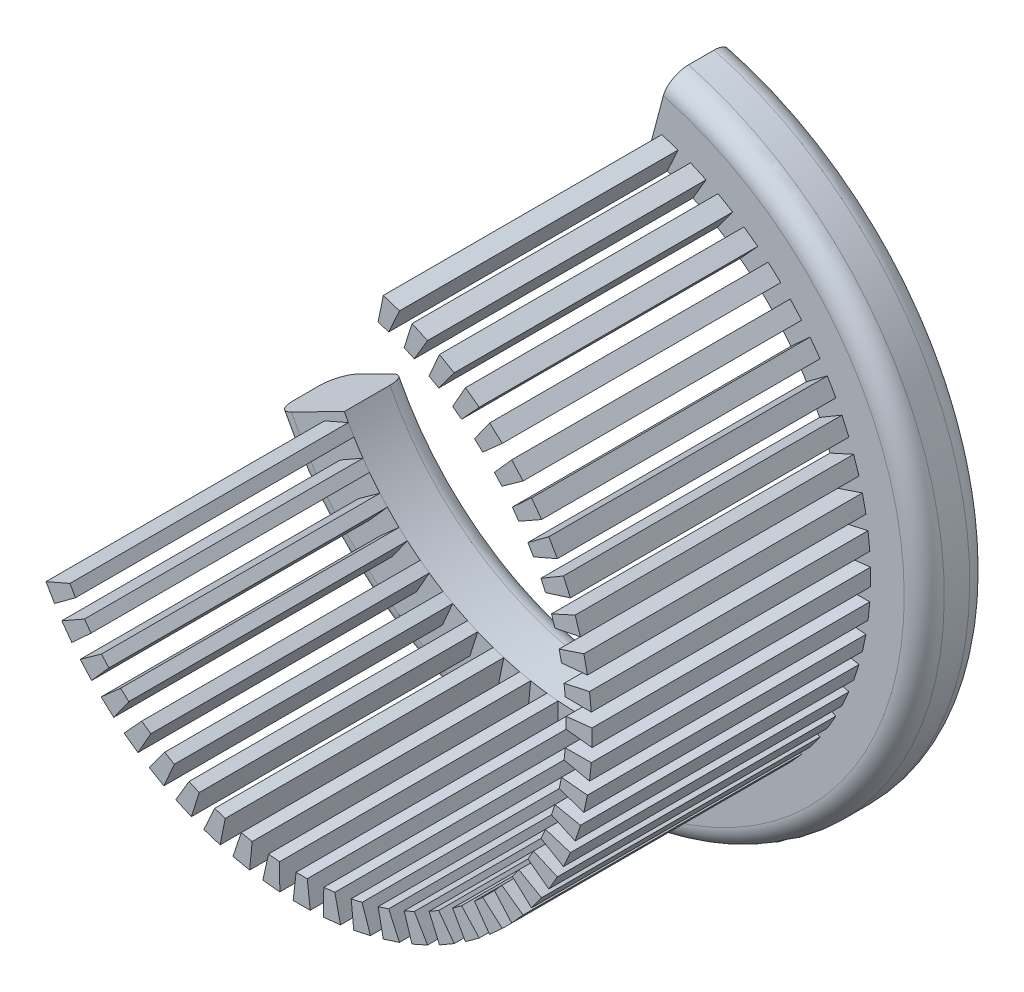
SolidWorks part; units mm, degrees
ref_plane "Přední rovina" through (0, 0, 0) normal (0, 0, 1) x (1, 0, 0)
ref_plane "Horní rovina" through (0, 0, 0) normal (0, 1, 0) x (1, 0, 0)
ref_plane "Pravá rovina" through (0, 0, 0) normal (1, 0, 0) x (0, 0, -1)
sketch "Skica1" plane through (0, 0, 0) normal (0, 0, 1) x (1, 0, 0)
  line L0 (0, 148.7514) -> (0, -162.0328) construction
  line L1 (-203.1858, 0) -> (251.9227, 0) construction
  line L2 (1.4, 79.8) -> (1.4, 78.4875)
  line L3 (0, 78.39) -> (0, 88.6)
  line L4 (-2.6, 88.6) -> (2.6, 88.6)
  line L5 (0, 88.6) -> (0, 80.7)
  line L6 (-1.7, 80.7) -> (1.7, 80.7)
  line L7 (0, 80.7) -> (0, 80.1)
  line L8 (6.7448, 80.4356) -> (10.1261, 80.0802)
  line L9 (1.4, 79.8) -> (1.7, 80.7)
  line L10 (2.6, 88.6) -> (1.7, 80.7)
  line L11 (-1.4, 79.8) -> (-1.7, 80.7)
  line L12 (-2.6, 88.6) -> (-1.7, 80.7)
  line L13 (6.6755, 88.3864) -> (6.7448, 80.4356)
  line L14 (6.6755, 88.3864) -> (11.847, 87.8429)
  line L15 (11.847, 87.8429) -> (10.1261, 80.0802)
  line L16 (6.949, 79.5092) -> (6.7448, 80.4356)
  line L17 (15.1156, 79.29) -> (18.4413, 78.5831)
  line L18 (9.7337, 79.2165) -> (10.1261, 80.0802)
  line L19 (15.8778, 87.2044) -> (15.1156, 79.29)
  line L20 (15.8778, 87.2044) -> (20.9642, 86.1233)
  line L21 (20.9642, 86.1233) -> (18.4413, 78.5831)
  line L22 (15.2219, 78.3473) -> (15.1156, 79.29)
  line L23 (23.3209, 77.2756) -> (26.5545, 76.2249)
  line L24 (17.9608, 77.7651) -> (18.4413, 78.5831)
  line L25 (24.9062, 85.0671) -> (23.3209, 77.2756)
  line L26 (24.9062, 85.0671) -> (29.8517, 83.4602)
  line L27 (29.8517, 83.4602) -> (26.5545, 76.2249)
  line L28 (23.3281, 76.3269) -> (23.3209, 77.2756)
  line L29 (31.2706, 74.4146) -> (34.3767, 73.0317)
  line L30 (25.991, 75.4617) -> (26.5545, 76.2249)
  line L31 (33.6616, 81.9976) -> (31.2706, 74.4146)
  line L32 (33.6616, 81.9976) -> (38.4121, 79.8826)
  line L33 (38.4121, 79.8826) -> (34.3767, 73.0317)
  line L34 (31.1786, 73.4704) -> (31.2706, 74.4146)
  line L35 (38.8778, 70.7383) -> (41.8222, 69.0383)
  line L36 (33.7365, 72.3315) -> (34.3767, 73.0317)
  line L37 (42.0483, 78.0299) -> (38.8778, 70.7383)
  line L38 (42.0483, 78.0299) -> (46.5517, 75.4299)
  line L39 (46.5517, 75.4299) -> (41.8222, 69.0383)
  line L40 (38.6876, 69.8088) -> (38.8778, 70.7383)
  line L41 (46.0589, 66.2869) -> (48.8096, 64.2884)
  line L42 (41.1124, 68.4088) -> (41.8222, 69.0383)
  line L43 (49.9743, 73.2071) -> (46.0589, 66.2869)
  line L44 (49.9743, 73.2071) -> (54.1812, 70.1507)
  line L45 (54.1812, 70.1507) -> (48.8096, 64.2884)
  line L46 (45.7726, 65.3825) -> (46.0589, 66.2869)
  line L47 (52.7355, 61.1093) -> (55.2622, 58.8343)
  line L48 (48.0379, 63.7367) -> (48.8096, 64.2884)
  line L49 (57.3528, 67.5824) -> (52.7355, 61.1093)
  line L50 (57.3528, 67.5824) -> (61.2171, 64.1029)
  line L51 (61.2171, 64.1029) -> (55.2622, 58.8343)
  line L52 (52.3562, 60.2397) -> (52.7355, 61.1093)
  line L53 (58.8343, 55.2622) -> (61.1093, 52.7355)
  line L54 (54.437, 58.3662) -> (55.2622, 58.8343)
  line L55 (64.1029, 61.2171) -> (58.8343, 55.2622)
  line L56 (64.1029, 61.2171) -> (67.5824, 57.3528)
  line L57 (67.5824, 57.3528) -> (61.1093, 52.7355)
  line L58 (58.3662, 54.437) -> (58.8343, 55.2622)
  line L59 (64.2884, 48.8096) -> (66.2869, 46.0589)
  line L60 (60.2397, 52.3562) -> (61.1093, 52.7355)
  line L61 (70.1507, 54.1812) -> (64.2884, 48.8096)
  line L62 (70.1507, 54.1812) -> (73.2071, 49.9743)
  line L63 (73.2071, 49.9743) -> (66.2869, 46.0589)
  line L64 (63.7367, 48.0379) -> (64.2884, 48.8096)
  line L65 (69.0383, 41.8222) -> (70.7383, 38.8778)
  line L66 (65.3825, 45.7726) -> (66.2869, 46.0589)
  line L67 (75.4299, 46.5517) -> (69.0383, 41.8222)
  line L68 (75.4299, 46.5517) -> (78.0299, 42.0483)
  line L69 (78.0299, 42.0483) -> (70.7383, 38.8778)
  line L70 (68.4088, 41.1124) -> (69.0383, 41.8222)
  line L71 (73.0317, 34.3767) -> (74.4146, 31.2706)
  line L72 (69.8088, 38.6876) -> (70.7383, 38.8778)
  line L73 (79.8826, 38.4121) -> (73.0317, 34.3767)
  line L74 (79.8826, 38.4121) -> (81.9976, 33.6616)
  line L75 (81.9976, 33.6616) -> (74.4146, 31.2706)
  line L76 (72.3315, 33.7365) -> (73.0317, 34.3767)
  line L77 (76.2249, 26.5545) -> (77.2756, 23.3209)
  line L78 (73.4704, 31.1786) -> (74.4146, 31.2706)
  line L79 (83.4602, 29.8517) -> (76.2249, 26.5545)
  line L80 (83.4602, 29.8517) -> (85.0671, 24.9062)
  line L81 (85.0671, 24.9062) -> (77.2756, 23.3209)
  line L82 (75.4617, 25.991) -> (76.2249, 26.5545)
  line L83 (78.5831, 18.4413) -> (79.29, 15.1156)
  line L84 (76.3269, 23.3281) -> (77.2756, 23.3209)
  line L85 (86.1233, 20.9642) -> (78.5831, 18.4413)
  line L86 (86.1233, 20.9642) -> (87.2044, 15.8778)
  line L87 (87.2044, 15.8778) -> (79.29, 15.1156)
  line L88 (77.7651, 17.9608) -> (78.5831, 18.4413)
  line L89 (80.0802, 10.1261) -> (80.4356, 6.7448)
  line L90 (78.3473, 15.2219) -> (79.29, 15.1156)
  line L91 (87.8429, 11.847) -> (80.0802, 10.1261)
  line L92 (87.8429, 11.847) -> (88.3864, 6.6755)
  line L93 (88.3864, 6.6755) -> (80.4356, 6.7448)
  line L94 (79.2165, 9.7337) -> (80.0802, 10.1261)
  line L95 (80.7, 1.7) -> (80.7, -1.7)
  line L96 (79.5092, 6.949) -> (80.4356, 6.7448)
  line L97 (88.6, 2.6) -> (80.7, 1.7)
  line L98 (88.6, 2.6) -> (88.6, -2.6)
  line L99 (88.6, -2.6) -> (80.7, -1.7)
  line L100 (79.8, 1.4) -> (80.7, 1.7)
  line L101 (80.4356, -6.7448) -> (80.0802, -10.1261)
  line L102 (79.8, -1.4) -> (80.7, -1.7)
  line L103 (88.3864, -6.6755) -> (80.4356, -6.7448)
  line L104 (88.3864, -6.6755) -> (87.8429, -11.847)
  line L105 (87.8429, -11.847) -> (80.0802, -10.1261)
  line L106 (79.5092, -6.949) -> (80.4356, -6.7448)
  line L107 (79.29, -15.1156) -> (78.5831, -18.4413)
  line L108 (79.2165, -9.7337) -> (80.0802, -10.1261)
  line L109 (87.2044, -15.8778) -> (79.29, -15.1156)
  line L110 (87.2044, -15.8778) -> (86.1233, -20.9642)
  line L111 (86.1233, -20.9642) -> (78.5831, -18.4413)
  line L112 (78.3473, -15.2219) -> (79.29, -15.1156)
  line L113 (77.2756, -23.3209) -> (76.2249, -26.5545)
  line L114 (77.7651, -17.9608) -> (78.5831, -18.4413)
  line L115 (85.0671, -24.9062) -> (77.2756, -23.3209)
  line L116 (85.0671, -24.9062) -> (83.4602, -29.8517)
  line L117 (83.4602, -29.8517) -> (76.2249, -26.5545)
  line L118 (76.3269, -23.3281) -> (77.2756, -23.3209)
  line L119 (74.4146, -31.2706) -> (73.0317, -34.3767)
  line L120 (75.4617, -25.991) -> (76.2249, -26.5545)
  line L121 (81.9976, -33.6616) -> (74.4146, -31.2706)
  line L122 (81.9976, -33.6616) -> (79.8826, -38.4121)
  line L123 (79.8826, -38.4121) -> (73.0317, -34.3767)
  line L124 (73.4704, -31.1786) -> (74.4146, -31.2706)
  line L125 (70.7383, -38.8778) -> (69.0383, -41.8222)
  line L126 (72.3315, -33.7365) -> (73.0317, -34.3767)
  line L127 (78.0299, -42.0483) -> (70.7383, -38.8778)
  line L128 (78.0299, -42.0483) -> (75.4299, -46.5517)
  line L129 (75.4299, -46.5517) -> (69.0383, -41.8222)
  line L130 (69.8088, -38.6876) -> (70.7383, -38.8778)
  line L131 (66.2869, -46.0589) -> (64.2884, -48.8096)
  line L132 (68.4088, -41.1124) -> (69.0383, -41.8222)
  line L133 (73.2071, -49.9743) -> (66.2869, -46.0589)
  line L134 (73.2071, -49.9743) -> (70.1507, -54.1812)
  line L135 (70.1507, -54.1812) -> (64.2884, -48.8096)
  line L136 (65.3825, -45.7726) -> (66.2869, -46.0589)
  line L137 (61.1093, -52.7355) -> (58.8343, -55.2622)
  line L138 (63.7367, -48.0379) -> (64.2884, -48.8096)
  line L139 (67.5824, -57.3528) -> (61.1093, -52.7355)
  line L140 (67.5824, -57.3528) -> (64.1029, -61.2171)
  line L141 (64.1029, -61.2171) -> (58.8343, -55.2622)
  line L142 (60.2397, -52.3562) -> (61.1093, -52.7355)
  line L143 (55.2622, -58.8343) -> (52.7355, -61.1093)
  line L144 (58.3662, -54.437) -> (58.8343, -55.2622)
  line L145 (61.2171, -64.1029) -> (55.2622, -58.8343)
  line L146 (61.2171, -64.1029) -> (57.3528, -67.5824)
  line L147 (57.3528, -67.5824) -> (52.7355, -61.1093)
  line L148 (54.437, -58.3662) -> (55.2622, -58.8343)
  line L149 (48.8096, -64.2884) -> (46.0589, -66.2869)
  line L150 (52.3562, -60.2397) -> (52.7355, -61.1093)
  line L151 (54.1812, -70.1507) -> (48.8096, -64.2884)
  line L152 (54.1812, -70.1507) -> (49.9743, -73.2071)
  line L153 (49.9743, -73.2071) -> (46.0589, -66.2869)
  line L154 (48.0379, -63.7367) -> (48.8096, -64.2884)
  line L155 (41.8222, -69.0383) -> (38.8778, -70.7383)
  line L156 (45.7726, -65.3825) -> (46.0589, -66.2869)
  line L157 (46.5517, -75.4299) -> (41.8222, -69.0383)
  line L158 (46.5517, -75.4299) -> (42.0483, -78.0299)
  line L159 (42.0483, -78.0299) -> (38.8778, -70.7383)
  line L160 (41.1124, -68.4088) -> (41.8222, -69.0383)
  line L161 (34.3767, -73.0317) -> (31.2706, -74.4146)
  line L162 (38.6876, -69.8088) -> (38.8778, -70.7383)
  line L163 (38.4121, -79.8826) -> (34.3767, -73.0317)
  line L164 (38.4121, -79.8826) -> (33.6616, -81.9976)
  line L165 (33.6616, -81.9976) -> (31.2706, -74.4146)
  line L166 (33.7365, -72.3315) -> (34.3767, -73.0317)
  line L167 (26.5545, -76.2249) -> (23.3209, -77.2756)
  line L168 (31.1786, -73.4704) -> (31.2706, -74.4146)
  line L169 (29.8517, -83.4602) -> (26.5545, -76.2249)
  line L170 (29.8517, -83.4602) -> (24.9062, -85.0671)
  line L171 (24.9062, -85.0671) -> (23.3209, -77.2756)
  line L172 (25.991, -75.4617) -> (26.5545, -76.2249)
  line L173 (18.4413, -78.5831) -> (15.1156, -79.29)
  line L174 (23.3281, -76.3269) -> (23.3209, -77.2756)
  line L175 (20.9642, -86.1233) -> (18.4413, -78.5831)
  line L176 (20.9642, -86.1233) -> (15.8778, -87.2044)
  line L177 (15.8778, -87.2044) -> (15.1156, -79.29)
  line L178 (17.9608, -77.7651) -> (18.4413, -78.5831)
  line L179 (10.1261, -80.0802) -> (6.7448, -80.4356)
  line L180 (15.2219, -78.3473) -> (15.1156, -79.29)
  line L181 (11.847, -87.8429) -> (10.1261, -80.0802)
  line L182 (11.847, -87.8429) -> (6.6755, -88.3864)
  line L183 (6.6755, -88.3864) -> (6.7448, -80.4356)
  line L184 (9.7337, -79.2165) -> (10.1261, -80.0802)
  line L185 (1.7, -80.7) -> (-1.7, -80.7)
  line L186 (6.949, -79.5092) -> (6.7448, -80.4356)
  line L187 (2.6, -88.6) -> (1.7, -80.7)
  line L188 (2.6, -88.6) -> (-2.6, -88.6)
  line L189 (-2.6, -88.6) -> (-1.7, -80.7)
  line L190 (1.4, -79.8) -> (1.7, -80.7)
  line L191 (-6.7448, -80.4356) -> (-10.1261, -80.0802)
  line L192 (-1.4, -79.8) -> (-1.7, -80.7)
  line L193 (-6.6755, -88.3864) -> (-6.7448, -80.4356)
  line L194 (-6.6755, -88.3864) -> (-11.847, -87.8429)
  line L195 (-11.847, -87.8429) -> (-10.1261, -80.0802)
  line L196 (-6.949, -79.5092) -> (-6.7448, -80.4356)
  line L197 (-15.1156, -79.29) -> (-18.4413, -78.5831)
  line L198 (-9.7337, -79.2165) -> (-10.1261, -80.0802)
  line L199 (-15.8778, -87.2044) -> (-15.1156, -79.29)
  line L200 (-15.8778, -87.2044) -> (-20.9642, -86.1233)
  line L201 (-20.9642, -86.1233) -> (-18.4413, -78.5831)
  line L202 (-15.2219, -78.3473) -> (-15.1156, -79.29)
  line L203 (-23.3209, -77.2756) -> (-26.5545, -76.2249)
  line L204 (-17.9608, -77.7651) -> (-18.4413, -78.5831)
  line L205 (-24.9062, -85.0671) -> (-23.3209, -77.2756)
  line L206 (-24.9062, -85.0671) -> (-29.8517, -83.4602)
  line L207 (-29.8517, -83.4602) -> (-26.5545, -76.2249)
  line L208 (-23.3281, -76.3269) -> (-23.3209, -77.2756)
  line L209 (-31.2706, -74.4146) -> (-34.3767, -73.0317)
  line L210 (-25.991, -75.4617) -> (-26.5545, -76.2249)
  line L211 (-33.6616, -81.9976) -> (-31.2706, -74.4146)
  line L212 (-33.6616, -81.9976) -> (-38.4121, -79.8826)
  line L213 (-38.4121, -79.8826) -> (-34.3767, -73.0317)
  line L214 (-31.1786, -73.4704) -> (-31.2706, -74.4146)
  line L215 (-38.8778, -70.7383) -> (-41.8222, -69.0383)
  line L216 (-33.7365, -72.3315) -> (-34.3767, -73.0317)
  line L217 (-42.0483, -78.0299) -> (-38.8778, -70.7383)
  line L218 (-42.0483, -78.0299) -> (-46.5517, -75.4299)
  line L219 (-46.5517, -75.4299) -> (-41.8222, -69.0383)
  line L220 (-38.6876, -69.8088) -> (-38.8778, -70.7383)
  line L221 (-46.0589, -66.2869) -> (-48.8096, -64.2884)
  line L222 (-41.1124, -68.4088) -> (-41.8222, -69.0383)
  line L223 (-49.9743, -73.2071) -> (-46.0589, -66.2869)
  line L224 (-49.9743, -73.2071) -> (-54.1812, -70.1507)
  line L225 (-54.1812, -70.1507) -> (-48.8096, -64.2884)
  line L226 (-45.7726, -65.3825) -> (-46.0589, -66.2869)
  line L227 (-45.7726, -65.3825) -> (-48.0379, -63.7367)
  line L228 (-48.0379, -63.7367) -> (-48.8096, -64.2884)
  line L229 (-57.3528, -67.5824) -> (-52.7355, -61.1093)
  line L230 (-57.3528, -67.5824) -> (-61.2171, -64.1029)
  line L231 (-61.2171, -64.1029) -> (-55.2622, -58.8343)
  line L232 (-52.3562, -60.2397) -> (-52.7355, -61.1093)
  line L233 (-52.7355, -61.1093) -> (-55.2622, -58.8343)
  line L234 (-54.437, -58.3662) -> (-55.2622, -58.8343)
  line L235 (-64.1029, -61.2171) -> (-58.8343, -55.2622)
  line L236 (-64.1029, -61.2171) -> (-67.5824, -57.3528)
  line L237 (-67.5824, -57.3528) -> (-61.1093, -52.7355)
  line L238 (-58.3662, -54.437) -> (-58.8343, -55.2622)
  line L239 (-58.8343, -55.2622) -> (-61.1093, -52.7355)
  line L240 (-60.2397, -52.3562) -> (-61.1093, -52.7355)
  line L241 (-70.1507, -54.1812) -> (-64.2884, -48.8096)
  line L242 (-70.1507, -54.1812) -> (-73.2071, -49.9743)
  line L243 (-73.2071, -49.9743) -> (-66.2869, -46.0589)
  line L244 (-63.7367, -48.0379) -> (-64.2884, -48.8096)
  line L245 (-64.2884, -48.8096) -> (-66.2869, -46.0589)
  line L246 (-65.3825, -45.7726) -> (-66.2869, -46.0589)
  line L247 (-75.4299, -46.5517) -> (-69.0383, -41.8222)
  line L248 (-75.4299, -46.5517) -> (-78.0299, -42.0483)
  line L249 (-78.0299, -42.0483) -> (-70.7383, -38.8778)
  line L250 (-68.4088, -41.1124) -> (-69.0383, -41.8222)
  line L251 (-69.0383, -41.8222) -> (-70.7383, -38.8778)
  line L252 (-69.8088, -38.6876) -> (-70.7383, -38.8778)
  line L253 (-79.8826, -38.4121) -> (-73.0317, -34.3767)
  line L254 (-79.8826, -38.4121) -> (-81.9976, -33.6616)
  line L255 (-81.9976, -33.6616) -> (-74.4146, -31.2706)
  line L256 (-72.3315, -33.7365) -> (-73.0317, -34.3767)
  line L257 (-73.0317, -34.3767) -> (-74.4146, -31.2706)
  line L258 (-73.4704, -31.1786) -> (-74.4146, -31.2706)
  line L259 (-83.4602, -29.8517) -> (-76.2249, -26.5545)
  line L260 (-83.4602, -29.8517) -> (-85.0671, -24.9062)
  line L261 (-85.0671, -24.9062) -> (-77.2756, -23.3209)
  line L262 (-75.4617, -25.991) -> (-76.2249, -26.5545)
  line L263 (-75.4617, -25.991) -> (-76.3269, -23.3281)
  line L264 (-76.3269, -23.3281) -> (-77.2756, -23.3209)
  line L265 (-86.1233, -20.9642) -> (-78.5831, -18.4413)
  line L266 (-86.1233, -20.9642) -> (-87.2044, -15.8778)
  line L267 (-87.2044, -15.8778) -> (-79.29, -15.1156)
  line L268 (-77.7651, -17.9608) -> (-78.5831, -18.4413)
  line L269 (-77.7651, -17.9608) -> (-78.3473, -15.2219)
  line L270 (-78.3473, -15.2219) -> (-79.29, -15.1156)
  line L271 (-87.8429, -11.847) -> (-80.0802, -10.1261)
  line L272 (-87.8429, -11.847) -> (-88.3864, -6.6755)
  line L273 (-88.3864, -6.6755) -> (-80.4356, -6.7448)
  line L274 (-79.2165, -9.7337) -> (-80.0802, -10.1261)
  line L275 (-76.2249, -26.5545) -> (-77.2756, -23.3209)
  line L276 (-79.5092, -6.949) -> (-80.4356, -6.7448)
  line L277 (-88.6, -2.6) -> (-80.7, -1.7)
  line L278 (-88.6, -2.6) -> (-88.6, 2.6)
  line L279 (-88.6, 2.6) -> (-80.7, 1.7)
  line L280 (-79.8, -1.4) -> (-80.7, -1.7)
  line L281 (-78.5831, -18.4413) -> (-79.29, -15.1156)
  line L282 (-79.8, 1.4) -> (-80.7, 1.7)
  line L283 (-88.3864, 6.6755) -> (-80.4356, 6.7448)
  line L284 (-88.3864, 6.6755) -> (-87.8429, 11.847)
  line L285 (-87.8429, 11.847) -> (-80.0802, 10.1261)
  line L286 (-79.5092, 6.949) -> (-80.4356, 6.7448)
  line L287 (-80.0802, -10.1261) -> (-80.4356, -6.7448)
  line L288 (-79.2165, 9.7337) -> (-80.0802, 10.1261)
  line L289 (-87.2044, 15.8778) -> (-79.29, 15.1156)
  line L290 (-87.2044, 15.8778) -> (-86.1233, 20.9642)
  line L291 (-86.1233, 20.9642) -> (-78.5831, 18.4413)
  line L292 (-78.3473, 15.2219) -> (-79.29, 15.1156)
  line L293 (-80.7, -1.7) -> (-80.7, 1.7)
  line L294 (-77.7651, 17.9608) -> (-78.5831, 18.4413)
  line L295 (-85.0671, 24.9062) -> (-77.2756, 23.3209)
  line L296 (-85.0671, 24.9062) -> (-83.4602, 29.8517)
  line L297 (-83.4602, 29.8517) -> (-76.2249, 26.5545)
  line L298 (-76.3269, 23.3281) -> (-77.2756, 23.3209)
  line L299 (-80.4356, 6.7448) -> (-80.0802, 10.1261)
  line L300 (-75.4617, 25.991) -> (-76.2249, 26.5545)
  line L301 (-81.9976, 33.6616) -> (-74.4146, 31.2706)
  line L302 (-81.9976, 33.6616) -> (-79.8826, 38.4121)
  line L303 (-79.8826, 38.4121) -> (-73.0317, 34.3767)
  line L304 (-73.4704, 31.1786) -> (-74.4146, 31.2706)
  line L305 (-79.29, 15.1156) -> (-78.5831, 18.4413)
  line L306 (-72.3315, 33.7365) -> (-73.0317, 34.3767)
  line L307 (-78.0299, 42.0483) -> (-70.7383, 38.8778)
  line L308 (-78.0299, 42.0483) -> (-75.4299, 46.5517)
  line L309 (-75.4299, 46.5517) -> (-69.0383, 41.8222)
  line L310 (-69.8088, 38.6876) -> (-70.7383, 38.8778)
  line L311 (-77.2756, 23.3209) -> (-76.2249, 26.5545)
  line L312 (-68.4088, 41.1124) -> (-69.0383, 41.8222)
  line L313 (-73.2071, 49.9743) -> (-66.2869, 46.0589)
  line L314 (-73.2071, 49.9743) -> (-70.1507, 54.1812)
  line L315 (-70.1507, 54.1812) -> (-64.2884, 48.8096)
  line L316 (-65.3825, 45.7726) -> (-66.2869, 46.0589)
  line L317 (-74.4146, 31.2706) -> (-73.0317, 34.3767)
  line L318 (-63.7367, 48.0379) -> (-64.2884, 48.8096)
  line L319 (-67.5824, 57.3528) -> (-61.1093, 52.7355)
  line L320 (-67.5824, 57.3528) -> (-64.1029, 61.2171)
  line L321 (-64.1029, 61.2171) -> (-58.8343, 55.2622)
  line L322 (-60.2397, 52.3562) -> (-61.1093, 52.7355)
  line L323 (-70.7383, 38.8778) -> (-69.0383, 41.8222)
  line L324 (-58.3662, 54.437) -> (-58.8343, 55.2622)
  line L325 (-61.2171, 64.1029) -> (-55.2622, 58.8343)
  line L326 (-61.2171, 64.1029) -> (-57.3528, 67.5824)
  line L327 (-57.3528, 67.5824) -> (-52.7355, 61.1093)
  line L328 (-54.437, 58.3662) -> (-55.2622, 58.8343)
  line L329 (-66.2869, 46.0589) -> (-64.2884, 48.8096)
  line L330 (-52.3562, 60.2397) -> (-52.7355, 61.1093)
  line L331 (-54.1812, 70.1507) -> (-48.8096, 64.2884)
  line L332 (-54.1812, 70.1507) -> (-49.9743, 73.2071)
  line L333 (-49.9743, 73.2071) -> (-46.0589, 66.2869)
  line L334 (-48.0379, 63.7367) -> (-48.8096, 64.2884)
  line L335 (-61.1093, 52.7355) -> (-58.8343, 55.2622)
  line L336 (-45.7726, 65.3825) -> (-46.0589, 66.2869)
  line L337 (-46.5517, 75.4299) -> (-41.8222, 69.0383)
  line L338 (-46.5517, 75.4299) -> (-42.0483, 78.0299)
  line L339 (-42.0483, 78.0299) -> (-38.8778, 70.7383)
  line L340 (-41.1124, 68.4088) -> (-41.8222, 69.0383)
  line L341 (-55.2622, 58.8343) -> (-52.7355, 61.1093)
  line L342 (-38.6876, 69.8088) -> (-38.8778, 70.7383)
  line L343 (-38.4121, 79.8826) -> (-34.3767, 73.0317)
  line L344 (-38.4121, 79.8826) -> (-33.6616, 81.9976)
  line L345 (-33.6616, 81.9976) -> (-31.2706, 74.4146)
  line L346 (-33.7365, 72.3315) -> (-34.3767, 73.0317)
  line L347 (-48.8096, 64.2884) -> (-46.0589, 66.2869)
  line L348 (-31.1786, 73.4704) -> (-31.2706, 74.4146)
  line L349 (-29.8517, 83.4602) -> (-26.5545, 76.2249)
  line L350 (-29.8517, 83.4602) -> (-24.9062, 85.0671)
  line L351 (-24.9062, 85.0671) -> (-23.3209, 77.2756)
  line L352 (-25.991, 75.4617) -> (-26.5545, 76.2249)
  line L353 (-41.8222, 69.0383) -> (-38.8778, 70.7383)
  line L354 (-23.3281, 76.3269) -> (-23.3209, 77.2756)
  line L355 (-20.9642, 86.1233) -> (-18.4413, 78.5831)
  line L356 (-20.9642, 86.1233) -> (-15.8778, 87.2044)
  line L357 (-15.8778, 87.2044) -> (-15.1156, 79.29)
  line L358 (-17.9608, 77.7651) -> (-18.4413, 78.5831)
  line L359 (-34.3767, 73.0317) -> (-31.2706, 74.4146)
  line L360 (-15.2219, 78.3473) -> (-15.1156, 79.29)
  line L361 (-11.847, 87.8429) -> (-10.1261, 80.0802)
  line L362 (-11.847, 87.8429) -> (-6.6755, 88.3864)
  line L363 (-6.6755, 88.3864) -> (-6.7448, 80.4356)
  line L364 (-9.7337, 79.2165) -> (-10.1261, 80.0802)
  line L365 (-26.5545, 76.2249) -> (-23.3209, 77.2756)
  line L366 (-6.949, 79.5092) -> (-6.7448, 80.4356)
  line L367 (-1.4, 79.8) -> (-1.4, 78.4875)
  line L368 (6.949, 79.5092) -> (6.8118, 78.2039)
  line L369 (9.7337, 79.2165) -> (9.5965, 77.9112)
  line L370 (15.2219, 78.3473) -> (14.9491, 77.0635)
  line L371 (17.9608, 77.7651) -> (17.6879, 76.4813)
  line L372 (23.3281, 76.3269) -> (22.9225, 75.0787)
  line L373 (25.991, 75.4617) -> (25.5855, 74.2134)
  line L374 (31.1786, 73.4704) -> (30.6448, 72.2713)
  line L375 (33.7365, 72.3315) -> (33.2027, 71.1325)
  line L376 (38.6876, 69.8088) -> (38.0313, 68.6722)
  line L377 (41.1124, 68.4088) -> (40.4562, 67.2722)
  line L378 (45.7726, 65.3825) -> (45.0012, 64.3206)
  line L379 (48.0379, 63.7367) -> (47.2664, 62.6748)
  line L380 (52.3562, 60.2397) -> (51.478, 59.2644)
  line L381 (54.437, 58.3662) -> (53.5588, 57.3908)
  line L382 (58.3662, 54.437) -> (57.3908, 53.5588)
  line L383 (60.2397, 52.3562) -> (59.2644, 51.478)
  line L384 (63.7367, 48.0379) -> (62.6748, 47.2664)
  line L385 (65.3825, 45.7726) -> (64.3206, 45.0012)
  line L386 (68.4088, 41.1124) -> (67.2722, 40.4562)
  line L387 (69.8088, 38.6876) -> (68.6722, 38.0313)
  line L388 (72.3315, 33.7365) -> (71.1325, 33.2027)
  line L389 (73.4704, 31.1786) -> (72.2713, 30.6448)
  line L390 (75.4617, 25.991) -> (74.2134, 25.5855)
  line L391 (76.3269, 23.3281) -> (75.0787, 22.9225)
  line L392 (77.7651, 17.9608) -> (76.4813, 17.6879)
  line L393 (78.3473, 15.2219) -> (77.0635, 14.9491)
  line L394 (79.2165, 9.7337) -> (77.9112, 9.5965)
  line L395 (79.5092, 6.949) -> (78.2039, 6.8118)
  line L396 (79.8, 1.4) -> (78.4875, 1.4)
  line L397 (79.8, -1.4) -> (78.4875, -1.4)
  line L398 (79.5092, -6.949) -> (78.2039, -6.8118)
  line L399 (79.2165, -9.7337) -> (77.9112, -9.5965)
  line L400 (78.3473, -15.2219) -> (77.0635, -14.9491)
  line L401 (77.7651, -17.9608) -> (76.4813, -17.6879)
  line L402 (76.3269, -23.3281) -> (75.0787, -22.9225)
  line L403 (75.4617, -25.991) -> (74.2134, -25.5855)
  line L404 (73.4704, -31.1786) -> (72.2713, -30.6448)
  line L405 (72.3315, -33.7365) -> (71.1325, -33.2027)
  line L406 (69.8088, -38.6876) -> (68.6722, -38.0313)
  line L407 (68.4088, -41.1124) -> (67.2722, -40.4562)
  line L408 (65.3825, -45.7726) -> (64.3206, -45.0012)
  line L409 (63.7367, -48.0379) -> (62.6748, -47.2664)
  line L410 (60.2397, -52.3562) -> (59.2644, -51.478)
  line L411 (58.3662, -54.437) -> (57.3908, -53.5588)
  line L412 (54.437, -58.3662) -> (53.5588, -57.3908)
  line L413 (52.3562, -60.2397) -> (51.478, -59.2644)
  line L414 (48.0379, -63.7367) -> (47.2664, -62.6748)
  line L415 (45.7726, -65.3825) -> (45.0012, -64.3206)
  line L416 (41.1124, -68.4088) -> (40.4562, -67.2722)
  line L417 (38.6876, -69.8088) -> (38.0313, -68.6722)
  line L418 (33.7365, -72.3315) -> (33.2027, -71.1325)
  line L419 (31.1786, -73.4704) -> (30.6448, -72.2713)
  line L420 (25.991, -75.4617) -> (25.5855, -74.2134)
  line L421 (23.3281, -76.3269) -> (22.9225, -75.0787)
  line L422 (17.9608, -77.7651) -> (17.6879, -76.4813)
  line L423 (15.2219, -78.3473) -> (14.9491, -77.0635)
  line L424 (9.7337, -79.2165) -> (9.5965, -77.9112)
  line L425 (6.949, -79.5092) -> (6.8118, -78.2039)
  line L426 (1.4, -79.8) -> (1.4, -78.4875)
  line L427 (-1.4, -79.8) -> (-1.4, -78.4875)
  line L428 (-6.949, -79.5092) -> (-6.8118, -78.2039)
  line L429 (-9.7337, -79.2165) -> (-9.5965, -77.9112)
  line L430 (-15.2219, -78.3473) -> (-14.9491, -77.0635)
  line L431 (-17.9608, -77.7651) -> (-17.6879, -76.4813)
  line L432 (-23.3281, -76.3269) -> (-22.9225, -75.0787)
  line L433 (-25.991, -75.4617) -> (-25.5855, -74.2134)
  line L434 (-31.1786, -73.4704) -> (-30.6448, -72.2713)
  line L435 (-33.7365, -72.3315) -> (-33.2027, -71.1325)
  line L436 (-38.6876, -69.8088) -> (-38.0313, -68.6722)
  line L437 (-41.1124, -68.4088) -> (-40.4562, -67.2722)
  line L438 (-45.7726, -65.3825) -> (-45.0012, -64.3206)
  line L439 (-48.0379, -63.7367) -> (-47.2664, -62.6748)
  line L440 (-52.3562, -60.2397) -> (-51.478, -59.2644)
  line L441 (-54.437, -58.3662) -> (-53.5588, -57.3908)
  line L442 (-58.3662, -54.437) -> (-57.3908, -53.5588)
  line L443 (-60.2397, -52.3562) -> (-59.2644, -51.478)
  line L444 (-63.7367, -48.0379) -> (-62.6748, -47.2664)
  line L445 (-65.3825, -45.7726) -> (-64.3206, -45.0012)
  line L446 (-68.4088, -41.1124) -> (-67.2722, -40.4562)
  line L447 (-69.8088, -38.6876) -> (-68.6722, -38.0313)
  line L448 (-72.3315, -33.7365) -> (-71.1325, -33.2027)
  line L449 (-73.4704, -31.1786) -> (-72.2713, -30.6448)
  line L450 (-75.4617, -25.991) -> (-74.2134, -25.5855)
  line L451 (-76.3269, -23.3281) -> (-75.0787, -22.9225)
  line L452 (-77.7651, -17.9608) -> (-76.4813, -17.6879)
  line L453 (-78.3473, -15.2219) -> (-77.0635, -14.9491)
  line L454 (-79.2165, -9.7337) -> (-77.9112, -9.5965)
  line L455 (-79.5092, -6.949) -> (-78.2039, -6.8118)
  line L456 (-79.8, -1.4) -> (-78.4875, -1.4)
  line L457 (-79.8, 1.4) -> (-78.4875, 1.4)
  line L458 (-79.5092, 6.949) -> (-78.2039, 6.8118)
  line L459 (-79.2165, 9.7337) -> (-77.9112, 9.5965)
  line L460 (-78.3473, 15.2219) -> (-77.0635, 14.9491)
  line L461 (-77.7651, 17.9608) -> (-76.4813, 17.6879)
  line L462 (-76.3269, 23.3281) -> (-75.0787, 22.9225)
  line L463 (-75.4617, 25.991) -> (-74.2134, 25.5855)
  line L464 (-73.4704, 31.1786) -> (-72.2713, 30.6448)
  line L465 (-72.3315, 33.7365) -> (-71.1325, 33.2027)
  line L466 (-69.8088, 38.6876) -> (-68.6722, 38.0313)
  line L467 (-68.4088, 41.1124) -> (-67.2722, 40.4562)
  line L468 (-65.3825, 45.7726) -> (-64.3206, 45.0012)
  line L469 (-63.7367, 48.0379) -> (-62.6748, 47.2664)
  line L470 (-60.2397, 52.3562) -> (-59.2644, 51.478)
  line L471 (-58.3662, 54.437) -> (-57.3908, 53.5588)
  line L472 (-54.437, 58.3662) -> (-53.5588, 57.3908)
  line L473 (-52.3562, 60.2397) -> (-51.478, 59.2644)
  line L474 (-48.0379, 63.7367) -> (-47.2664, 62.6748)
  line L475 (-45.7726, 65.3825) -> (-45.0012, 64.3206)
  line L476 (-41.1124, 68.4088) -> (-40.4562, 67.2722)
  line L477 (-38.6876, 69.8088) -> (-38.0313, 68.6722)
  line L478 (-33.7365, 72.3315) -> (-33.2027, 71.1325)
  line L479 (-31.1786, 73.4704) -> (-30.6448, 72.2713)
  line L480 (-25.991, 75.4617) -> (-25.5855, 74.2134)
  line L481 (-23.3281, 76.3269) -> (-22.9225, 75.0787)
  line L482 (-17.9608, 77.7651) -> (-17.6879, 76.4813)
  line L483 (-15.2219, 78.3473) -> (-14.9491, 77.0635)
  line L484 (-9.7337, 79.2165) -> (-9.5965, 77.9112)
  line L485 (-6.949, 79.5092) -> (-6.8118, 78.2039)
  line L486 (-18.4413, 78.5831) -> (-15.1156, 79.29)
  line L487 (-10.1261, 80.0802) -> (-6.7448, 80.4356)
  arc A0 (-1.4, 78.4875) -> (-6.8118, 78.2039) centre (0, 0) ccw
  circle A1 centre (0, 0) radius 127
  arc A2 (-9.5965, 77.9112) -> (-14.9491, 77.0635) centre (0, 0) ccw
  arc A3 (-17.6879, 76.4813) -> (-22.9225, 75.0787) centre (0, 0) ccw
  arc A4 (-25.5855, 74.2134) -> (-30.6448, 72.2713) centre (0, 0) ccw
  arc A5 (6.8118, 78.2039) -> (1.4, 78.4875) centre (0, 0) ccw
  arc A6 (14.9491, 77.0635) -> (9.5965, 77.9112) centre (0, 0) ccw
  arc A7 (-33.2027, 71.1325) -> (-38.0313, 68.6722) centre (0, 0) ccw
  arc A8 (-40.4562, 67.2722) -> (-45.0012, 64.3206) centre (0, 0) ccw
  arc A9 (-47.2664, 62.6748) -> (-51.478, 59.2644) centre (0, 0) ccw
  arc A10 (-53.5588, 57.3908) -> (-57.3908, 53.5588) centre (0, 0) ccw
  arc A11 (-59.2644, 51.478) -> (-62.6748, 47.2664) centre (0, 0) ccw
  arc A12 (-64.3206, 45.0012) -> (-67.2722, 40.4562) centre (0, 0) ccw
  arc A13 (-68.6722, 38.0313) -> (-71.1325, 33.2027) centre (0, 0) ccw
  arc A14 (-72.2713, 30.6448) -> (-74.2134, 25.5855) centre (0, 0) ccw
  arc A15 (-75.0787, 22.9225) -> (-76.4813, 17.6879) centre (0, 0) ccw
  arc A16 (-77.0635, 14.9491) -> (-77.9112, 9.5965) centre (0, 0) ccw
  arc A17 (-78.2039, 6.8118) -> (-78.4875, 1.4) centre (0, 0) ccw
  arc A18 (-78.4875, -1.4) -> (-78.2039, -6.8118) centre (0, 0) ccw
  arc A19 (-77.9112, -9.5965) -> (-77.0635, -14.9491) centre (0, 0) ccw
  arc A20 (-76.4813, -17.6879) -> (-75.0787, -22.9225) centre (0, 0) ccw
  arc A21 (-74.2134, -25.5855) -> (-72.2713, -30.6448) centre (0, 0) ccw
  arc A22 (-71.1325, -33.2027) -> (-68.6722, -38.0313) centre (0, 0) ccw
  arc A23 (-67.2722, -40.4562) -> (-64.3206, -45.0012) centre (0, 0) ccw
  arc A24 (-62.6748, -47.2664) -> (-59.2644, -51.478) centre (0, 0) ccw
  arc A25 (-57.3908, -53.5588) -> (-53.5588, -57.3908) centre (0, 0) ccw
  arc A26 (-51.478, -59.2644) -> (-47.2664, -62.6748) centre (0, 0) ccw
  arc A27 (-45.0012, -64.3206) -> (-40.4562, -67.2722) centre (0, 0) ccw
  arc A28 (-38.0313, -68.6722) -> (-33.2027, -71.1325) centre (0, 0) ccw
  arc A29 (-30.6448, -72.2713) -> (-25.5855, -74.2134) centre (0, 0) ccw
  arc A30 (-22.9225, -75.0787) -> (-17.6879, -76.4813) centre (0, 0) ccw
  arc A31 (-14.9491, -77.0635) -> (-9.5965, -77.9112) centre (0, 0) ccw
  arc A32 (-6.8118, -78.2039) -> (-1.4, -78.4875) centre (0, 0) ccw
  arc A33 (1.4, -78.4875) -> (6.8118, -78.2039) centre (0, 0) ccw
  arc A34 (9.5965, -77.9112) -> (14.9491, -77.0635) centre (0, 0) ccw
  arc A35 (17.6879, -76.4813) -> (22.9225, -75.0787) centre (0, 0) ccw
  arc A36 (25.5855, -74.2134) -> (30.6448, -72.2713) centre (0, 0) ccw
  arc A37 (33.2027, -71.1325) -> (38.0313, -68.6722) centre (0, 0) ccw
  arc A38 (40.4562, -67.2722) -> (45.0012, -64.3206) centre (0, 0) ccw
  arc A39 (47.2664, -62.6748) -> (51.478, -59.2644) centre (0, 0) ccw
  arc A40 (53.5588, -57.3908) -> (57.3908, -53.5588) centre (0, 0) ccw
  arc A41 (59.2644, -51.478) -> (62.6748, -47.2664) centre (0, 0) ccw
  arc A42 (64.3206, -45.0012) -> (67.2722, -40.4562) centre (0, 0) ccw
  arc A43 (68.6722, -38.0313) -> (71.1325, -33.2027) centre (0, 0) ccw
  arc A44 (72.2713, -30.6448) -> (74.2134, -25.5855) centre (0, 0) ccw
  arc A45 (75.0787, -22.9225) -> (76.4813, -17.6879) centre (0, 0) ccw
  arc A46 (77.0635, -14.9491) -> (77.9112, -9.5965) centre (0, 0) ccw
  arc A47 (78.2039, -6.8118) -> (78.4875, -1.4) centre (0, 0) ccw
  arc A48 (78.4875, 1.4) -> (78.2039, 6.8118) centre (0, 0) ccw
  arc A49 (77.9112, 9.5965) -> (77.0635, 14.9491) centre (0, 0) ccw
  arc A50 (76.4813, 17.6879) -> (75.0787, 22.9225) centre (0, 0) ccw
  arc A51 (74.2134, 25.5855) -> (72.2713, 30.6448) centre (0, 0) ccw
  arc A52 (71.1325, 33.2027) -> (68.6722, 38.0313) centre (0, 0) ccw
  arc A53 (67.2722, 40.4562) -> (64.3206, 45.0012) centre (0, 0) ccw
  arc A54 (62.6748, 47.2664) -> (59.2644, 51.478) centre (0, 0) ccw
  arc A55 (22.9225, 75.0787) -> (17.6879, 76.4813) centre (0, 0) ccw
  arc A56 (30.6448, 72.2713) -> (25.5855, 74.2134) centre (0, 0) ccw
  arc A57 (38.0313, 68.6722) -> (33.2027, 71.1325) centre (0, 0) ccw
  arc A58 (45.0012, 64.3206) -> (40.4562, 67.2722) centre (0, 0) ccw
  arc A59 (51.478, 59.2644) -> (47.2664, 62.6748) centre (0, 0) ccw
  arc A60 (57.3908, 53.5588) -> (53.5588, 57.3908) centre (0, 0) ccw
  point P375 (0, 0)
  point P612 (0, 0)
  point P620 (0, 0)
  dimension "D1" = 254
  dimension "D2" = 157
  dimension "D14" = 78.5
  dimension "D3" = 1.3125
  dimension "D4" = 10.21
  dimension "D5" = 2.6
  dimension "D6" = 7.9
  dimension "D7" = 1.7
  dimension "D8" = 0.6
  dimension "D9" = 60
  dimension "D11" = 3.4
  dimension "D13" = 1.4
  dimension "D15" = 88.6
  dimension "D10" = 60
  dimension "D12" = 60
extrude "Přidat vysunutím1" add sketch "Skica1" along normal blind 85 contours L295 L311 L297 L296 | L301 L317 L303 L302 | L307 L323 L309 L308 | L313 L329 L315 L314 | L325 L341 L327 L326 | L331 L347 L333 L332 | L337 L353 L339 L338 | L343 L359 L345 L344 | L349 L365 L351 L350 | L355 L486 L357 L356 | L361 L487 L363 L362 | L289 L305 L291 L290 | L283 L299 L285 L284 | L271 L287 L273 L272 | L259 L275 L261 L260 | L277 L293 L279 L278 | L253 L257 L255 L254 | L247 L251 L249 L248 | L241 L245 L243 L242 | L235 L239 L237 L236 | L229 L233 L231 L230 | L225 L224 L223 L221 | L219 L218 L217 L215 | L213 L212 L211 L209 | L207 L206 L205 L203 | L201 L200 L199 L197 | L195 L194 L193 L191 | L189 L188 L187 L185 | L183 L182 L181 L179 | L177 L176 L175 L173 | L171 L170 L169 L167 | L165 L164 L163 L161 | L159 L158 L157 L155 | L153 L152 L151 L149 | L147 L146 L145 L143 | L141 L140 L139 L137 | L135 L134 L133 L131 | L129 L128 L127 L125 | L123 L122 L121 L119 | L117 L116 L115 L113 | L111 L110 L109 L107 | L105 L104 L103 L101 | L99 L98 L97 L95 | L93 L92 L91 L89 | L87 L86 L85 L83 | L81 L80 L79 L77 | L75 L74 L73 L71 | L69 L68 L67 L65 | L63 L62 L61 L59 | L57 L56 L55 L53 | L51 L50 L49 L47 | L45 L44 L43 L41 | L39 L38 L37 L35 | L33 L32 L31 L29 | L27 L26 L25 L23 | L21 L20 L19 L17 | L15 L14 L13 L8 | L10 L4 L3 L6 | L4 L12 L6 L3 | L319 L335 L321 L320 | L265 L281 L267 L266
sketch "Skica2" plane through (0, 0, 0) normal (0, 0, 1) x (1, 0, 0)
  circle A0 centre (0, 0) radius 80.7179
  circle A1 centre (0, 0) radius 105
  dimension "D1" = 210
extrude "Přidat vysunutím2" add sketch "Skica2" against normal blind 20
scale "Měřítko1" scale about origin uniform scaling yes scale factor 0.655
sketch "Skica3" plane through (0, 0, -13.1) normal (0, 0, -1) x (-1, 0, 0)
  line L0 (0, 0) -> (-23.3909, 88.0733)
  line L1 (0, 0) -> (83.0539, -42.1839)
  circle A0 centre (0, 0) radius 93.1527
  dimension "D1" = 131.8
extrude "Odebrat vysunutím1" cut sketch "Skica3" against normal through all
sketch "Skica4" [suppressed] plane through (0, 0, 0) normal (0, 0, 1) x (1, 0, 0)
  line L0 (0, 148.7514) -> (0, -162.0328) construction
  line L1 (-203.1858, 0) -> (251.9227, 0) construction
  line L2 (1.4, 79.8) -> (1.4, 78.4875)
  line L3 (0, 78.5) -> (0, 88.71)
  line L4 (-2.855, 88.71) -> (2.855, 88.71)
  line L5 (0, 88.71) -> (0, 80.4)
  line L7 (0, 80.4) -> (0, 79.8)
  line L9 (1.4, 79.8) -> (1.945, 80.4)
  line L10 (2.855, 88.71) -> (1.945, 80.4)
  line L11 (-1.4, 79.8) -> (-1.945, 80.4)
  line L12 (-2.855, 88.71) -> (-1.945, 80.4)
  line L13 (6.4334, 88.5225) -> (6.4697, 80.1629)
  line L14 (6.4334, 88.5225) -> (12.1121, 87.9256)
  line L15 (12.1121, 87.9256) -> (10.3384, 79.7563)
  line L16 (6.949, 79.5092) -> (6.4697, 80.1629)
  line L18 (9.7337, 79.2165) -> (10.3384, 79.7563)
  line L19 (15.6512, 87.3651) -> (14.8136, 79.0475)
  line L20 (15.6512, 87.3651) -> (21.2365, 86.1779)
  line L21 (21.2365, 86.1779) -> (18.6186, 78.2387)
  line L22 (15.2219, 78.3473) -> (14.8136, 79.0475)
  line L24 (17.9608, 77.7651) -> (18.6186, 78.2387)
  line L25 (24.6976, 85.2505) -> (22.9952, 77.066)
  line L26 (24.6976, 85.2505) -> (30.1282, 83.486)
  line L27 (30.1282, 83.486) -> (26.6948, 75.8639)
  line L28 (23.3281, 76.3269) -> (22.9952, 77.066)
  line L30 (25.991, 75.4617) -> (26.6948, 75.8639)
  line L31 (33.4734, 82.2019) -> (30.9248, 74.2402)
  line L32 (33.4734, 82.2019) -> (38.6898, 79.8794)
  line L33 (38.6898, 79.8794) -> (34.4785, 72.658)
  line L34 (31.1786, 73.4704) -> (30.9248, 74.2402)
  line L36 (33.7365, 72.3315) -> (34.4785, 72.658)
  line L37 (41.8825, 78.2526) -> (38.5156, 70.6009)
  line L38 (41.8825, 78.2526) -> (46.8275, 75.3976)
  line L39 (46.8275, 75.3976) -> (41.8844, 68.6559)
  line L40 (38.6876, 69.8088) -> (38.5156, 70.6009)
  line L42 (41.1124, 68.4088) -> (41.8844, 68.6559)
  line L43 (49.8327, 73.446) -> (45.6844, 66.1882)
  line L44 (49.8327, 73.446) -> (54.4522, 70.0898)
  line L45 (54.4522, 70.0898) -> (48.8315, 63.9017)
  line L46 (45.7726, 65.3825) -> (45.6844, 66.1882)
  line L48 (48.0379, 63.7367) -> (48.8315, 63.9017)
  line L49 (57.2369, 67.8347) -> (52.3527, 61.0503)
  line L50 (57.2369, 67.8347) -> (61.4803, 64.014)
  line L51 (61.4803, 64.014) -> (55.2435, 58.4474)
  line L52 (52.3562, 60.2397) -> (52.3527, 61.0503)
  line L54 (54.437, 58.3662) -> (55.2435, 58.4474)
  line L55 (64.014, 61.4803) -> (58.4474, 55.2435)
  line L56 (64.014, 61.4803) -> (67.8347, 57.2369)
  line L57 (67.8347, 57.2369) -> (61.0503, 52.3527)
  line L58 (58.3662, 54.437) -> (58.4474, 55.2435)
  line L60 (60.2397, 52.3562) -> (61.0503, 52.3527)
  line L61 (70.0898, 54.4522) -> (63.9017, 48.8315)
  line L62 (70.0898, 54.4522) -> (73.446, 49.8327)
  line L63 (73.446, 49.8327) -> (66.1882, 45.6844)
  line L64 (63.7367, 48.0379) -> (63.9017, 48.8315)
  line L66 (65.3825, 45.7726) -> (66.1882, 45.6844)
  line L67 (75.3976, 46.8275) -> (68.6559, 41.8844)
  line L68 (75.3976, 46.8275) -> (78.2526, 41.8825)
  line L69 (78.2526, 41.8825) -> (70.6009, 38.5156)
  line L70 (68.4088, 41.1124) -> (68.6559, 41.8844)
  line L72 (69.8088, 38.6876) -> (70.6009, 38.5156)
  line L73 (79.8794, 38.6898) -> (72.658, 34.4785)
  line L74 (79.8794, 38.6898) -> (82.2019, 33.4734)
  line L75 (82.2019, 33.4734) -> (74.2402, 30.9248)
  line L76 (72.3315, 33.7365) -> (72.658, 34.4785)
  line L78 (73.4704, 31.1786) -> (74.2402, 30.9248)
  line L79 (83.486, 30.1282) -> (75.8639, 26.6948)
  line L80 (83.486, 30.1282) -> (85.2505, 24.6976)
  line L81 (85.2505, 24.6976) -> (77.066, 22.9952)
  line L82 (75.4617, 25.991) -> (75.8639, 26.6948)
  line L84 (76.3269, 23.3281) -> (77.066, 22.9952)
  line L85 (86.1779, 21.2365) -> (78.2387, 18.6186)
  line L86 (86.1779, 21.2365) -> (87.3651, 15.6512)
  line L87 (87.3651, 15.6512) -> (79.0475, 14.8136)
  line L88 (77.7651, 17.9608) -> (78.2387, 18.6186)
  line L90 (78.3473, 15.2219) -> (79.0475, 14.8136)
  line L91 (87.9256, 12.1121) -> (79.7563, 10.3384)
  line L92 (87.9256, 12.1121) -> (88.5225, 6.4334)
  line L93 (88.5225, 6.4334) -> (80.1629, 6.4697)
  line L94 (79.2165, 9.7337) -> (79.7563, 10.3384)
  line L96 (79.5092, 6.949) -> (80.1629, 6.4697)
  line L97 (88.71, 2.855) -> (80.4, 1.945)
  line L98 (88.71, 2.855) -> (88.71, -2.855)
  line L99 (88.71, -2.855) -> (80.4, -1.945)
  line L100 (79.8, 1.4) -> (80.4, 1.945)
  line L102 (79.8, -1.4) -> (80.4, -1.945)
  line L103 (88.5225, -6.4334) -> (80.1629, -6.4697)
  line L104 (88.5225, -6.4334) -> (87.9256, -12.1121)
  line L105 (87.9256, -12.1121) -> (79.7563, -10.3384)
  line L106 (79.5092, -6.949) -> (80.1629, -6.4697)
  line L108 (79.2165, -9.7337) -> (79.7563, -10.3384)
  line L109 (87.3651, -15.6512) -> (79.0475, -14.8136)
  line L110 (87.3651, -15.6512) -> (86.1779, -21.2365)
  line L111 (86.1779, -21.2365) -> (78.2387, -18.6186)
  line L112 (78.3473, -15.2219) -> (79.0475, -14.8136)
  line L114 (77.7651, -17.9608) -> (78.2387, -18.6186)
  line L115 (85.2505, -24.6976) -> (77.066, -22.9952)
  line L116 (85.2505, -24.6976) -> (83.486, -30.1282)
  line L117 (83.486, -30.1282) -> (75.8639, -26.6948)
  line L118 (76.3269, -23.3281) -> (77.066, -22.9952)
  line L120 (75.4617, -25.991) -> (75.8639, -26.6948)
  line L121 (82.2019, -33.4734) -> (74.2402, -30.9248)
  line L122 (82.2019, -33.4734) -> (79.8794, -38.6898)
  line L123 (79.8794, -38.6898) -> (72.658, -34.4785)
  line L124 (73.4704, -31.1786) -> (74.2402, -30.9248)
  line L126 (72.3315, -33.7365) -> (72.658, -34.4785)
  line L127 (78.2526, -41.8825) -> (70.6009, -38.5156)
  line L128 (78.2526, -41.8825) -> (75.3976, -46.8275)
  line L129 (75.3976, -46.8275) -> (68.6559, -41.8844)
  line L130 (69.8088, -38.6876) -> (70.6009, -38.5156)
  line L132 (68.4088, -41.1124) -> (68.6559, -41.8844)
  line L133 (73.446, -49.8327) -> (66.1882, -45.6844)
  line L134 (73.446, -49.8327) -> (70.0898, -54.4522)
  line L135 (70.0898, -54.4522) -> (63.9017, -48.8315)
  line L136 (65.3825, -45.7726) -> (66.1882, -45.6844)
  line L138 (63.7367, -48.0379) -> (63.9017, -48.8315)
  line L139 (67.8347, -57.2369) -> (61.0503, -52.3527)
  line L140 (67.8347, -57.2369) -> (64.014, -61.4803)
  line L141 (64.014, -61.4803) -> (58.4474, -55.2435)
  line L142 (60.2397, -52.3562) -> (61.0503, -52.3527)
  line L144 (58.3662, -54.437) -> (58.4474, -55.2435)
  line L145 (61.4803, -64.014) -> (55.2435, -58.4474)
  line L146 (61.4803, -64.014) -> (57.2369, -67.8347)
  line L147 (57.2369, -67.8347) -> (52.3527, -61.0503)
  line L148 (54.437, -58.3662) -> (55.2435, -58.4474)
  line L150 (52.3562, -60.2397) -> (52.3527, -61.0503)
  line L151 (54.4522, -70.0898) -> (48.8315, -63.9017)
  line L152 (54.4522, -70.0898) -> (49.8327, -73.446)
  line L153 (49.8327, -73.446) -> (45.6844, -66.1882)
  line L154 (48.0379, -63.7367) -> (48.8315, -63.9017)
  line L156 (45.7726, -65.3825) -> (45.6844, -66.1882)
  line L157 (46.8275, -75.3976) -> (41.8844, -68.6559)
  line L158 (46.8275, -75.3976) -> (41.8825, -78.2526)
  line L159 (41.8825, -78.2526) -> (38.5156, -70.6009)
  line L160 (41.1124, -68.4088) -> (41.8844, -68.6559)
  line L162 (38.6876, -69.8088) -> (38.5156, -70.6009)
  line L163 (38.6898, -79.8794) -> (34.4785, -72.658)
  line L164 (38.6898, -79.8794) -> (33.4734, -82.2019)
  line L165 (33.4734, -82.2019) -> (30.9248, -74.2402)
  line L166 (33.7365, -72.3315) -> (34.4785, -72.658)
  line L168 (31.1786, -73.4704) -> (30.9248, -74.2402)
  line L169 (30.1282, -83.486) -> (26.6948, -75.8639)
  line L170 (30.1282, -83.486) -> (24.6976, -85.2505)
  line L171 (24.6976, -85.2505) -> (22.9952, -77.066)
  line L172 (25.991, -75.4617) -> (26.6948, -75.8639)
  line L174 (23.3281, -76.3269) -> (22.9952, -77.066)
  line L175 (21.2365, -86.1779) -> (18.6186, -78.2387)
  line L176 (21.2365, -86.1779) -> (15.6512, -87.3651)
  line L177 (15.6512, -87.3651) -> (14.8136, -79.0475)
  line L178 (17.9608, -77.7651) -> (18.6186, -78.2387)
  line L180 (15.2219, -78.3473) -> (14.8136, -79.0475)
  line L181 (12.1121, -87.9256) -> (10.3384, -79.7563)
  line L182 (12.1121, -87.9256) -> (6.4334, -88.5225)
  line L183 (6.4334, -88.5225) -> (6.4697, -80.1629)
  line L184 (9.7337, -79.2165) -> (10.3384, -79.7563)
  line L186 (6.949, -79.5092) -> (6.4697, -80.1629)
  line L187 (2.855, -88.71) -> (1.945, -80.4)
  line L188 (2.855, -88.71) -> (-2.855, -88.71)
  line L189 (-2.855, -88.71) -> (-1.945, -80.4)
  line L190 (1.4, -79.8) -> (1.945, -80.4)
  line L192 (-1.4, -79.8) -> (-1.945, -80.4)
  line L193 (-6.4334, -88.5225) -> (-6.4697, -80.1629)
  line L194 (-6.4334, -88.5225) -> (-12.1121, -87.9256)
  line L195 (-12.1121, -87.9256) -> (-10.3384, -79.7563)
  line L196 (-6.949, -79.5092) -> (-6.4697, -80.1629)
  line L198 (-9.7337, -79.2165) -> (-10.3384, -79.7563)
  line L199 (-15.6512, -87.3651) -> (-14.8136, -79.0475)
  line L200 (-15.6512, -87.3651) -> (-21.2365, -86.1779)
  line L201 (-21.2365, -86.1779) -> (-18.6186, -78.2387)
  line L202 (-15.2219, -78.3473) -> (-14.8136, -79.0475)
  line L204 (-17.9608, -77.7651) -> (-18.6186, -78.2387)
  line L205 (-24.6976, -85.2505) -> (-22.9952, -77.066)
  line L206 (-24.6976, -85.2505) -> (-30.1282, -83.486)
  line L207 (-30.1282, -83.486) -> (-26.6948, -75.8639)
  line L208 (-23.3281, -76.3269) -> (-22.9952, -77.066)
  line L210 (-25.991, -75.4617) -> (-26.6948, -75.8639)
  line L211 (-33.4734, -82.2019) -> (-30.9248, -74.2402)
  line L212 (-33.4734, -82.2019) -> (-38.6898, -79.8794)
  line L213 (-38.6898, -79.8794) -> (-34.4785, -72.658)
  line L214 (-31.1786, -73.4704) -> (-30.9248, -74.2402)
  line L216 (-33.7365, -72.3315) -> (-34.4785, -72.658)
  line L217 (-41.8825, -78.2526) -> (-38.5156, -70.6009)
  line L218 (-41.8825, -78.2526) -> (-46.8275, -75.3976)
  line L219 (-46.8275, -75.3976) -> (-41.8844, -68.6559)
  line L220 (-38.6876, -69.8088) -> (-38.5156, -70.6009)
  line L222 (-41.1124, -68.4088) -> (-41.8844, -68.6559)
  line L223 (-49.8327, -73.446) -> (-45.6844, -66.1882)
  line L224 (-49.8327, -73.446) -> (-54.4522, -70.0898)
  line L225 (-54.4522, -70.0898) -> (-48.8315, -63.9017)
  line L226 (-45.7726, -65.3825) -> (-45.6844, -66.1882)
  line L227 (-45.7726, -65.3825) -> (-48.0379, -63.7367)
  line L228 (-48.0379, -63.7367) -> (-48.8315, -63.9017)
  line L229 (-57.2369, -67.8347) -> (-52.3527, -61.0503)
  line L230 (-57.2369, -67.8347) -> (-61.4803, -64.014)
  line L231 (-61.4803, -64.014) -> (-55.2435, -58.4474)
  line L232 (-52.3562, -60.2397) -> (-52.3527, -61.0503)
  line L234 (-54.437, -58.3662) -> (-55.2435, -58.4474)
  line L235 (-64.014, -61.4803) -> (-58.4474, -55.2435)
  line L236 (-64.014, -61.4803) -> (-67.8347, -57.2369)
  line L237 (-67.8347, -57.2369) -> (-61.0503, -52.3527)
  line L238 (-58.3662, -54.437) -> (-58.4474, -55.2435)
  line L240 (-60.2397, -52.3562) -> (-61.0503, -52.3527)
  line L241 (-70.0898, -54.4522) -> (-63.9017, -48.8315)
  line L242 (-70.0898, -54.4522) -> (-73.446, -49.8327)
  line L243 (-73.446, -49.8327) -> (-66.1882, -45.6844)
  line L244 (-63.7367, -48.0379) -> (-63.9017, -48.8315)
  line L246 (-65.3825, -45.7726) -> (-66.1882, -45.6844)
  line L247 (-75.3976, -46.8275) -> (-68.6559, -41.8844)
  line L248 (-75.3976, -46.8275) -> (-78.2526, -41.8825)
  line L249 (-78.2526, -41.8825) -> (-70.6009, -38.5156)
  line L250 (-68.4088, -41.1124) -> (-68.6559, -41.8844)
  line L252 (-69.8088, -38.6876) -> (-70.6009, -38.5156)
  line L253 (-79.8794, -38.6898) -> (-72.658, -34.4785)
  line L254 (-79.8794, -38.6898) -> (-82.2019, -33.4734)
  line L255 (-82.2019, -33.4734) -> (-74.2402, -30.9248)
  line L256 (-72.3315, -33.7365) -> (-72.658, -34.4785)
  line L258 (-73.4704, -31.1786) -> (-74.2402, -30.9248)
  line L259 (-83.486, -30.1282) -> (-75.8639, -26.6948)
  line L260 (-83.486, -30.1282) -> (-85.2505, -24.6976)
  line L261 (-85.2505, -24.6976) -> (-77.066, -22.9952)
  line L262 (-75.4617, -25.991) -> (-75.8639, -26.6948)
  line L263 (-75.4617, -25.991) -> (-76.3269, -23.3281)
  line L264 (-76.3269, -23.3281) -> (-77.066, -22.9952)
  line L265 (-86.1779, -21.2365) -> (-78.2387, -18.6186)
  line L266 (-86.1779, -21.2365) -> (-87.3651, -15.6512)
  line L267 (-87.3651, -15.6512) -> (-79.0475, -14.8136)
  line L268 (-77.7651, -17.9608) -> (-78.2387, -18.6186)
  line L269 (-77.7651, -17.9608) -> (-78.3473, -15.2219)
  line L270 (-78.3473, -15.2219) -> (-79.0475, -14.8136)
  line L271 (-87.9256, -12.1121) -> (-79.7563, -10.3384)
  line L272 (-87.9256, -12.1121) -> (-88.5225, -6.4334)
  line L273 (-88.5225, -6.4334) -> (-80.1629, -6.4697)
  line L274 (-79.2165, -9.7337) -> (-79.7563, -10.3384)
  line L276 (-79.5092, -6.949) -> (-80.1629, -6.4697)
  line L277 (-88.71, -2.855) -> (-80.4, -1.945)
  line L278 (-88.71, -2.855) -> (-88.71, 2.855)
  line L279 (-88.71, 2.855) -> (-80.4, 1.945)
  line L280 (-79.8, -1.4) -> (-80.4, -1.945)
  line L282 (-79.8, 1.4) -> (-80.4, 1.945)
  line L283 (-88.5225, 6.4334) -> (-80.1629, 6.4697)
  line L284 (-88.5225, 6.4334) -> (-87.9256, 12.1121)
  line L285 (-87.9256, 12.1121) -> (-79.7563, 10.3384)
  line L286 (-79.5092, 6.949) -> (-80.1629, 6.4697)
  line L288 (-79.2165, 9.7337) -> (-79.7563, 10.3384)
  line L289 (-87.3651, 15.6512) -> (-79.0475, 14.8136)
  line L290 (-87.3651, 15.6512) -> (-86.1779, 21.2365)
  line L291 (-86.1779, 21.2365) -> (-78.2387, 18.6186)
  line L292 (-78.3473, 15.2219) -> (-79.0475, 14.8136)
  line L294 (-77.7651, 17.9608) -> (-78.2387, 18.6186)
  line L295 (-85.2505, 24.6976) -> (-77.066, 22.9952)
  line L296 (-85.2505, 24.6976) -> (-83.486, 30.1282)
  line L297 (-83.486, 30.1282) -> (-75.8639, 26.6948)
  line L298 (-76.3269, 23.3281) -> (-77.066, 22.9952)
  line L300 (-75.4617, 25.991) -> (-75.8639, 26.6948)
  line L301 (-82.2019, 33.4734) -> (-74.2402, 30.9248)
  line L302 (-82.2019, 33.4734) -> (-79.8794, 38.6898)
  line L303 (-79.8794, 38.6898) -> (-72.658, 34.4785)
  line L304 (-73.4704, 31.1786) -> (-74.2402, 30.9248)
  line L306 (-72.3315, 33.7365) -> (-72.658, 34.4785)
  line L307 (-78.2526, 41.8825) -> (-70.6009, 38.5156)
  line L308 (-78.2526, 41.8825) -> (-75.3976, 46.8275)
  line L309 (-75.3976, 46.8275) -> (-68.6559, 41.8844)
  line L310 (-69.8088, 38.6876) -> (-70.6009, 38.5156)
  line L312 (-68.4088, 41.1124) -> (-68.6559, 41.8844)
  line L313 (-73.446, 49.8327) -> (-66.1882, 45.6844)
  line L314 (-73.446, 49.8327) -> (-70.0898, 54.4522)
  line L315 (-70.0898, 54.4522) -> (-63.9017, 48.8315)
  line L316 (-65.3825, 45.7726) -> (-66.1882, 45.6844)
  line L318 (-63.7367, 48.0379) -> (-63.9017, 48.8315)
  line L319 (-67.8347, 57.2369) -> (-61.0503, 52.3527)
  line L320 (-67.8347, 57.2369) -> (-64.014, 61.4803)
  line L321 (-64.014, 61.4803) -> (-58.4474, 55.2435)
  line L322 (-60.2397, 52.3562) -> (-61.0503, 52.3527)
  line L324 (-58.3662, 54.437) -> (-58.4474, 55.2435)
  line L325 (-61.4803, 64.014) -> (-55.2435, 58.4474)
  line L326 (-61.4803, 64.014) -> (-57.2369, 67.8347)
  line L327 (-57.2369, 67.8347) -> (-52.3527, 61.0503)
  line L328 (-54.437, 58.3662) -> (-55.2435, 58.4474)
  line L330 (-52.3562, 60.2397) -> (-52.3527, 61.0503)
  line L331 (-54.4522, 70.0898) -> (-48.8315, 63.9017)
  line L332 (-54.4522, 70.0898) -> (-49.8327, 73.446)
  line L333 (-49.8327, 73.446) -> (-45.6844, 66.1882)
  line L334 (-48.0379, 63.7367) -> (-48.8315, 63.9017)
  line L336 (-45.7726, 65.3825) -> (-45.6844, 66.1882)
  line L337 (-46.8275, 75.3976) -> (-41.8844, 68.6559)
  line L338 (-46.8275, 75.3976) -> (-41.8825, 78.2526)
  line L339 (-41.8825, 78.2526) -> (-38.5156, 70.6009)
  line L340 (-41.1124, 68.4088) -> (-41.8844, 68.6559)
  line L342 (-38.6876, 69.8088) -> (-38.5156, 70.6009)
  line L343 (-38.6898, 79.8794) -> (-34.4785, 72.658)
  line L344 (-38.6898, 79.8794) -> (-33.4734, 82.2019)
  line L345 (-33.4734, 82.2019) -> (-30.9248, 74.2402)
  line L346 (-33.7365, 72.3315) -> (-34.4785, 72.658)
  line L348 (-31.1786, 73.4704) -> (-30.9248, 74.2402)
  line L349 (-30.1282, 83.486) -> (-26.6948, 75.8639)
  line L350 (-30.1282, 83.486) -> (-24.6976, 85.2505)
  line L351 (-24.6976, 85.2505) -> (-22.9952, 77.066)
  line L352 (-25.991, 75.4617) -> (-26.6948, 75.8639)
  line L354 (-23.3281, 76.3269) -> (-22.9952, 77.066)
  line L355 (-21.2365, 86.1779) -> (-18.6186, 78.2387)
  line L356 (-21.2365, 86.1779) -> (-15.6512, 87.3651)
  line L357 (-15.6512, 87.3651) -> (-14.8136, 79.0475)
  line L358 (-17.9608, 77.7651) -> (-18.6186, 78.2387)
  line L360 (-15.2219, 78.3473) -> (-14.8136, 79.0475)
  line L361 (-12.1121, 87.9256) -> (-10.3384, 79.7563)
  line L362 (-12.1121, 87.9256) -> (-6.4334, 88.5225)
  line L363 (-6.4334, 88.5225) -> (-6.4697, 80.1629)
  line L364 (-9.7337, 79.2165) -> (-10.3384, 79.7563)
  line L366 (-6.949, 79.5092) -> (-6.4697, 80.1629)
  line L367 (-1.4, 79.8) -> (-1.4, 78.4875)
  line L368 (6.949, 79.5092) -> (6.8118, 78.2039)
  line L369 (9.7337, 79.2165) -> (9.5965, 77.9112)
  line L370 (15.2219, 78.3473) -> (14.9491, 77.0635)
  line L371 (17.9608, 77.7651) -> (17.6879, 76.4813)
  line L372 (23.3281, 76.3269) -> (22.9225, 75.0787)
  line L373 (25.991, 75.4617) -> (25.5855, 74.2134)
  line L374 (31.1786, 73.4704) -> (30.6448, 72.2713)
  line L375 (33.7365, 72.3315) -> (33.2027, 71.1325)
  line L376 (38.6876, 69.8088) -> (38.0313, 68.6722)
  line L377 (41.1124, 68.4088) -> (40.4562, 67.2722)
  line L378 (45.7726, 65.3825) -> (45.0012, 64.3206)
  line L379 (48.0379, 63.7367) -> (47.2664, 62.6748)
  line L380 (52.3562, 60.2397) -> (51.478, 59.2644)
  line L381 (54.437, 58.3662) -> (53.5588, 57.3908)
  line L382 (58.3662, 54.437) -> (57.3908, 53.5588)
  line L383 (60.2397, 52.3562) -> (59.2644, 51.478)
  line L384 (63.7367, 48.0379) -> (62.6748, 47.2664)
  line L385 (65.3825, 45.7726) -> (64.3206, 45.0012)
  line L386 (68.4088, 41.1124) -> (67.2722, 40.4562)
  line L387 (69.8088, 38.6876) -> (68.6722, 38.0313)
  line L388 (72.3315, 33.7365) -> (71.1325, 33.2027)
  line L389 (73.4704, 31.1786) -> (72.2713, 30.6448)
  line L390 (75.4617, 25.991) -> (74.2134, 25.5855)
  line L391 (76.3269, 23.3281) -> (75.0787, 22.9225)
  line L392 (77.7651, 17.9608) -> (76.4813, 17.6879)
  line L393 (78.3473, 15.2219) -> (77.0635, 14.9491)
  line L394 (79.2165, 9.7337) -> (77.9112, 9.5965)
  line L395 (79.5092, 6.949) -> (78.2039, 6.8118)
  line L396 (79.8, 1.4) -> (78.4875, 1.4)
  line L397 (79.8, -1.4) -> (78.4875, -1.4)
  line L398 (79.5092, -6.949) -> (78.2039, -6.8118)
  line L399 (79.2165, -9.7337) -> (77.9112, -9.5965)
  line L400 (78.3473, -15.2219) -> (77.0635, -14.9491)
  line L401 (77.7651, -17.9608) -> (76.4813, -17.6879)
  line L402 (76.3269, -23.3281) -> (75.0787, -22.9225)
  line L403 (75.4617, -25.991) -> (74.2134, -25.5855)
  line L404 (73.4704, -31.1786) -> (72.2713, -30.6448)
  line L405 (72.3315, -33.7365) -> (71.1325, -33.2027)
  line L406 (69.8088, -38.6876) -> (68.6722, -38.0313)
  line L407 (68.4088, -41.1124) -> (67.2722, -40.4562)
  line L408 (65.3825, -45.7726) -> (64.3206, -45.0012)
  line L409 (63.7367, -48.0379) -> (62.6748, -47.2664)
  line L410 (60.2397, -52.3562) -> (59.2644, -51.478)
  line L411 (58.3662, -54.437) -> (57.3908, -53.5588)
  line L412 (54.437, -58.3662) -> (53.5588, -57.3908)
  line L413 (52.3562, -60.2397) -> (51.478, -59.2644)
  line L414 (48.0379, -63.7367) -> (47.2664, -62.6748)
  line L415 (45.7726, -65.3825) -> (45.0012, -64.3206)
  line L416 (41.1124, -68.4088) -> (40.4562, -67.2722)
  line L417 (38.6876, -69.8088) -> (38.0313, -68.6722)
  line L418 (33.7365, -72.3315) -> (33.2027, -71.1325)
  line L419 (31.1786, -73.4704) -> (30.6448, -72.2713)
  line L420 (25.991, -75.4617) -> (25.5855, -74.2134)
  line L421 (23.3281, -76.3269) -> (22.9225, -75.0787)
  line L422 (17.9608, -77.7651) -> (17.6879, -76.4813)
  line L423 (15.2219, -78.3473) -> (14.9491, -77.0635)
  line L424 (9.7337, -79.2165) -> (9.5965, -77.9112)
  line L425 (6.949, -79.5092) -> (6.8118, -78.2039)
  line L426 (1.4, -79.8) -> (1.4, -78.4875)
  line L427 (-1.4, -79.8) -> (-1.4, -78.4875)
  line L428 (-6.949, -79.5092) -> (-6.8118, -78.2039)
  line L429 (-9.7337, -79.2165) -> (-9.5965, -77.9112)
  line L430 (-15.2219, -78.3473) -> (-14.9491, -77.0635)
  line L431 (-17.9608, -77.7651) -> (-17.6879, -76.4813)
  line L432 (-23.3281, -76.3269) -> (-22.9225, -75.0787)
  line L433 (-25.991, -75.4617) -> (-25.5855, -74.2134)
  line L434 (-31.1786, -73.4704) -> (-30.6448, -72.2713)
  line L435 (-33.7365, -72.3315) -> (-33.2027, -71.1325)
  line L436 (-38.6876, -69.8088) -> (-38.0313, -68.6722)
  line L437 (-41.1124, -68.4088) -> (-40.4562, -67.2722)
  line L438 (-45.7726, -65.3825) -> (-45.0012, -64.3206)
  line L439 (-48.0379, -63.7367) -> (-47.2664, -62.6748)
  line L440 (-52.3562, -60.2397) -> (-51.478, -59.2644)
  line L441 (-54.437, -58.3662) -> (-53.5588, -57.3908)
  line L442 (-58.3662, -54.437) -> (-57.3908, -53.5588)
  line L443 (-60.2397, -52.3562) -> (-59.2644, -51.478)
  line L444 (-63.7367, -48.0379) -> (-62.6748, -47.2664)
  line L445 (-65.3825, -45.7726) -> (-64.3206, -45.0012)
  line L446 (-68.4088, -41.1124) -> (-67.2722, -40.4562)
  line L447 (-69.8088, -38.6876) -> (-68.6722, -38.0313)
  line L448 (-72.3315, -33.7365) -> (-71.1325, -33.2027)
  line L449 (-73.4704, -31.1786) -> (-72.2713, -30.6448)
  line L450 (-75.4617, -25.991) -> (-74.2134, -25.5855)
  line L451 (-76.3269, -23.3281) -> (-75.0787, -22.9225)
  line L452 (-77.7651, -17.9608) -> (-76.4813, -17.6879)
  line L453 (-78.3473, -15.2219) -> (-77.0635, -14.9491)
  line L454 (-79.2165, -9.7337) -> (-77.9112, -9.5965)
  line L455 (-79.5092, -6.949) -> (-78.2039, -6.8118)
  line L456 (-79.8, -1.4) -> (-78.4875, -1.4)
  line L457 (-79.8, 1.4) -> (-78.4875, 1.4)
  line L458 (-79.5092, 6.949) -> (-78.2039, 6.8118)
  line L459 (-79.2165, 9.7337) -> (-77.9112, 9.5965)
  line L460 (-78.3473, 15.2219) -> (-77.0635, 14.9491)
  line L461 (-77.7651, 17.9608) -> (-76.4813, 17.6879)
  line L462 (-76.3269, 23.3281) -> (-75.0787, 22.9225)
  line L463 (-75.4617, 25.991) -> (-74.2134, 25.5855)
  line L464 (-73.4704, 31.1786) -> (-72.2713, 30.6448)
  line L465 (-72.3315, 33.7365) -> (-71.1325, 33.2027)
  line L466 (-69.8088, 38.6876) -> (-68.6722, 38.0313)
  line L467 (-68.4088, 41.1124) -> (-67.2722, 40.4562)
  line L468 (-65.3825, 45.7726) -> (-64.3206, 45.0012)
  line L469 (-63.7367, 48.0379) -> (-62.6748, 47.2664)
  line L470 (-60.2397, 52.3562) -> (-59.2644, 51.478)
  line L471 (-58.3662, 54.437) -> (-57.3908, 53.5588)
  line L472 (-54.437, 58.3662) -> (-53.5588, 57.3908)
  line L473 (-52.3562, 60.2397) -> (-51.478, 59.2644)
  line L474 (-48.0379, 63.7367) -> (-47.2664, 62.6748)
  line L475 (-45.7726, 65.3825) -> (-45.0012, 64.3206)
  line L476 (-41.1124, 68.4088) -> (-40.4562, 67.2722)
  line L477 (-38.6876, 69.8088) -> (-38.0313, 68.6722)
  line L478 (-33.7365, 72.3315) -> (-33.2027, 71.1325)
  line L479 (-31.1786, 73.4704) -> (-30.6448, 72.2713)
  line L480 (-25.991, 75.4617) -> (-25.5855, 74.2134)
  line L481 (-23.3281, 76.3269) -> (-22.9225, 75.0787)
  line L482 (-17.9608, 77.7651) -> (-17.6879, 76.4813)
  line L483 (-15.2219, 78.3473) -> (-14.9491, 77.0635)
  line L484 (-9.7337, 79.2165) -> (-9.5965, 77.9112)
  line L485 (-6.949, 79.5092) -> (-6.8118, 78.2039)
  arc A0 (-1.4, 78.4875) -> (-6.8118, 78.2039) centre (0, 0) ccw
  circle A1 centre (0, 0) radius 127
  arc A2 (-9.5965, 77.9112) -> (-14.9491, 77.0635) centre (0, 0) ccw
  arc A3 (-17.6879, 76.4813) -> (-22.9225, 75.0787) centre (0, 0) ccw
  arc A4 (-25.5855, 74.2134) -> (-30.6448, 72.2713) centre (0, 0) ccw
  arc A5 (6.8118, 78.2039) -> (1.4, 78.4875) centre (0, 0) ccw
  arc A6 (14.9491, 77.0635) -> (9.5965, 77.9112) centre (0, 0) ccw
  arc A7 (-33.2027, 71.1325) -> (-38.0313, 68.6722) centre (0, 0) ccw
  arc A8 (-40.4562, 67.2722) -> (-45.0012, 64.3206) centre (0, 0) ccw
  arc A9 (-47.2664, 62.6748) -> (-51.478, 59.2644) centre (0, 0) ccw
  arc A10 (-53.5588, 57.3908) -> (-57.3908, 53.5588) centre (0, 0) ccw
  arc A11 (-59.2644, 51.478) -> (-62.6748, 47.2664) centre (0, 0) ccw
  arc A12 (-64.3206, 45.0012) -> (-67.2722, 40.4562) centre (0, 0) ccw
  arc A13 (-68.6722, 38.0313) -> (-71.1325, 33.2027) centre (0, 0) ccw
  arc A14 (-72.2713, 30.6448) -> (-74.2134, 25.5855) centre (0, 0) ccw
  arc A15 (-75.0787, 22.9225) -> (-76.4813, 17.6879) centre (0, 0) ccw
  arc A16 (-77.0635, 14.9491) -> (-77.9112, 9.5965) centre (0, 0) ccw
  arc A17 (-78.2039, 6.8118) -> (-78.4875, 1.4) centre (0, 0) ccw
  arc A18 (-78.4875, -1.4) -> (-78.2039, -6.8118) centre (0, 0) ccw
  arc A19 (-77.9112, -9.5965) -> (-77.0635, -14.9491) centre (0, 0) ccw
  arc A20 (-76.4813, -17.6879) -> (-75.0787, -22.9225) centre (0, 0) ccw
  arc A21 (-74.2134, -25.5855) -> (-72.2713, -30.6448) centre (0, 0) ccw
  arc A22 (-71.1325, -33.2027) -> (-68.6722, -38.0313) centre (0, 0) ccw
  arc A23 (-67.2722, -40.4562) -> (-64.3206, -45.0012) centre (0, 0) ccw
  arc A24 (-62.6748, -47.2664) -> (-59.2644, -51.478) centre (0, 0) ccw
  arc A25 (-57.3908, -53.5588) -> (-53.5588, -57.3908) centre (0, 0) ccw
  arc A26 (-51.478, -59.2644) -> (-47.2664, -62.6748) centre (0, 0) ccw
  arc A27 (-45.0012, -64.3206) -> (-40.4562, -67.2722) centre (0, 0) ccw
  arc A28 (-38.0313, -68.6722) -> (-33.2027, -71.1325) centre (0, 0) ccw
  arc A29 (-30.6448, -72.2713) -> (-25.5855, -74.2134) centre (0, 0) ccw
  arc A30 (-22.9225, -75.0787) -> (-17.6879, -76.4813) centre (0, 0) ccw
  arc A31 (-14.9491, -77.0635) -> (-9.5965, -77.9112) centre (0, 0) ccw
  arc A32 (-6.8118, -78.2039) -> (-1.4, -78.4875) centre (0, 0) ccw
  arc A33 (1.4, -78.4875) -> (6.8118, -78.2039) centre (0, 0) ccw
  arc A34 (9.5965, -77.9112) -> (14.9491, -77.0635) centre (0, 0) ccw
  arc A35 (17.6879, -76.4813) -> (22.9225, -75.0787) centre (0, 0) ccw
  arc A36 (25.5855, -74.2134) -> (30.6448, -72.2713) centre (0, 0) ccw
  arc A37 (33.2027, -71.1325) -> (38.0313, -68.6722) centre (0, 0) ccw
  arc A38 (40.4562, -67.2722) -> (45.0012, -64.3206) centre (0, 0) ccw
  arc A39 (47.2664, -62.6748) -> (51.478, -59.2644) centre (0, 0) ccw
  arc A40 (53.5588, -57.3908) -> (57.3908, -53.5588) centre (0, 0) ccw
  arc A41 (59.2644, -51.478) -> (62.6748, -47.2664) centre (0, 0) ccw
  arc A42 (64.3206, -45.0012) -> (67.2722, -40.4562) centre (0, 0) ccw
  arc A43 (68.6722, -38.0313) -> (71.1325, -33.2027) centre (0, 0) ccw
  arc A44 (72.2713, -30.6448) -> (74.2134, -25.5855) centre (0, 0) ccw
  arc A45 (75.0787, -22.9225) -> (76.4813, -17.6879) centre (0, 0) ccw
  arc A46 (77.0635, -14.9491) -> (77.9112, -9.5965) centre (0, 0) ccw
  arc A47 (78.2039, -6.8118) -> (78.4875, -1.4) centre (0, 0) ccw
  arc A48 (78.4875, 1.4) -> (78.2039, 6.8118) centre (0, 0) ccw
  arc A49 (77.9112, 9.5965) -> (77.0635, 14.9491) centre (0, 0) ccw
  arc A50 (76.4813, 17.6879) -> (75.0787, 22.9225) centre (0, 0) ccw
  arc A51 (74.2134, 25.5855) -> (72.2713, 30.6448) centre (0, 0) ccw
  arc A52 (71.1325, 33.2027) -> (68.6722, 38.0313) centre (0, 0) ccw
  arc A53 (67.2722, 40.4562) -> (64.3206, 45.0012) centre (0, 0) ccw
  arc A54 (62.6748, 47.2664) -> (59.2644, 51.478) centre (0, 0) ccw
  arc A55 (22.9225, 75.0787) -> (17.6879, 76.4813) centre (0, 0) ccw
  arc A56 (30.6448, 72.2713) -> (25.5855, 74.2134) centre (0, 0) ccw
  arc A57 (38.0313, 68.6722) -> (33.2027, 71.1325) centre (0, 0) ccw
  arc A58 (45.0012, 64.3206) -> (40.4562, 67.2722) centre (0, 0) ccw
  arc A59 (51.478, 59.2644) -> (47.2664, 62.6748) centre (0, 0) ccw
  arc A60 (57.3908, 53.5588) -> (53.5588, 57.3908) centre (0, 0) ccw
  point P375 (0, 0)
  point P612 (0, 0)
  dimension "D1" = 254
  dimension "D2" = 157
  dimension "D3" = 1.3125
  dimension "D4" = 10.21
  dimension "D5" = 2.855
  dimension "D6" = 8.31
  dimension "D7" = 1.945
  dimension "D8" = 0.6
  dimension "D9" = 60
  dimension "D10" = 60
fillet "Zaoblit1" radius 4 3 edges at (53.4682, -43.2568, 0) (41.1033, -33.2533, -13.1) (53.4682, -43.2568, -13.1)
